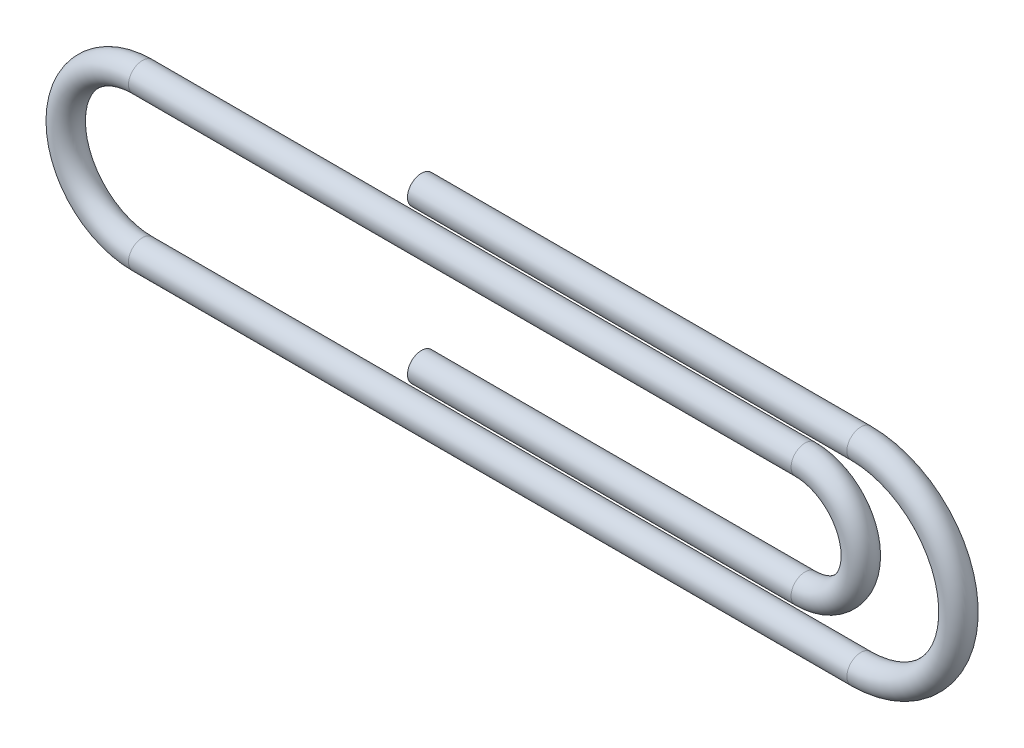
SolidWorks part; units mm, degrees
ref_plane "Front Plane" through (0, 0, 0) normal (0, 0, 1) x (1, 0, 0)
ref_plane "Top Plane" through (0, 0, 0) normal (0, 1, 0) x (1, 0, 0)
ref_plane "Right Plane" through (0, 0, 0) normal (1, 0, 0) x (0, 0, -1)
sketch "Sketch1" plane through (0, 0, 0) normal (0, 0, 1) x (1, 0, 0)
  line L0 (-13.75, 3.5) -> (2, 3.5)
  line L1 (2, -3.5) -> (-23.75, -3.5)
  line L2 (-23.75, 2) -> (0, 2)
  line L3 (0, -2) -> (-13.75, -2)
  line L4 (0, 0) -> (2, 0) construction
  arc A0 (2, 3.5) -> (2, -3.5) centre (2, 0) cw
  arc A1 (-23.75, -3.5) -> (-23.75, 2) centre (-23.75, -0.75) cw
  arc A2 (0, 2) -> (0, -2) centre (0, 0) cw
  dimension "D2" = 1.5
  dimension "D3" = 1.5
  dimension "D4" = 32
  dimension "D5" = 3.5
  dimension "D1" = 10
ref_plane "Plane1" through (-13.75, 3.5, 0) normal (1, 0, 0) x (0, 0, -1)
sketch "Sketch2" plane through (-13.75, 3.5, 0) normal (1, 0, 0) x (0, 0, -1)
  circle A0 centre (0, 0) radius 0.5
  dimension "D1" = 1
sweep "Sweep1" add profiles "Sketch2" path "Sketch1"
